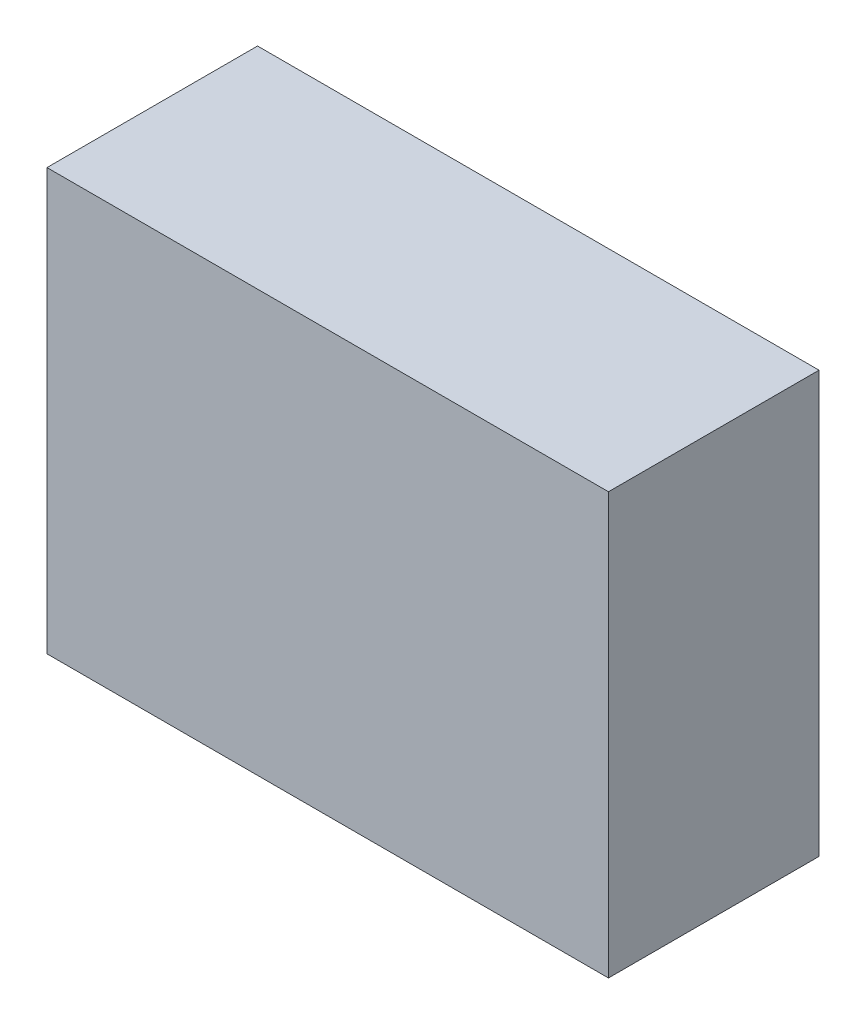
SolidWorks part; units mm, degrees
ref_plane "Vorne" through (0, 0, 0) normal (0, 0, 1) x (1, 0, 0)
ref_plane "Oben" through (0, 0, 0) normal (0, 1, 0) x (1, 0, 0)
ref_plane "Rechts" through (0, 0, 0) normal (1, 0, 0) x (0, 0, -1)
sketch "Skizze1" plane through (0, 0, 0) normal (0, 0, 1) x (1, 0, 0)
  line L1 (0, 0) -> (80, 0)
  line L2 (0, 0) -> (0, 60)
  line L3 (0, 60) -> (80, 60)
  line L4 (80, 0) -> (80, 60)
  dimension "D1" = 60
  dimension "D2" = 80
extrude "Aufsatz-Linear austragen1" add sketch "Skizze1" along normal blind 30
